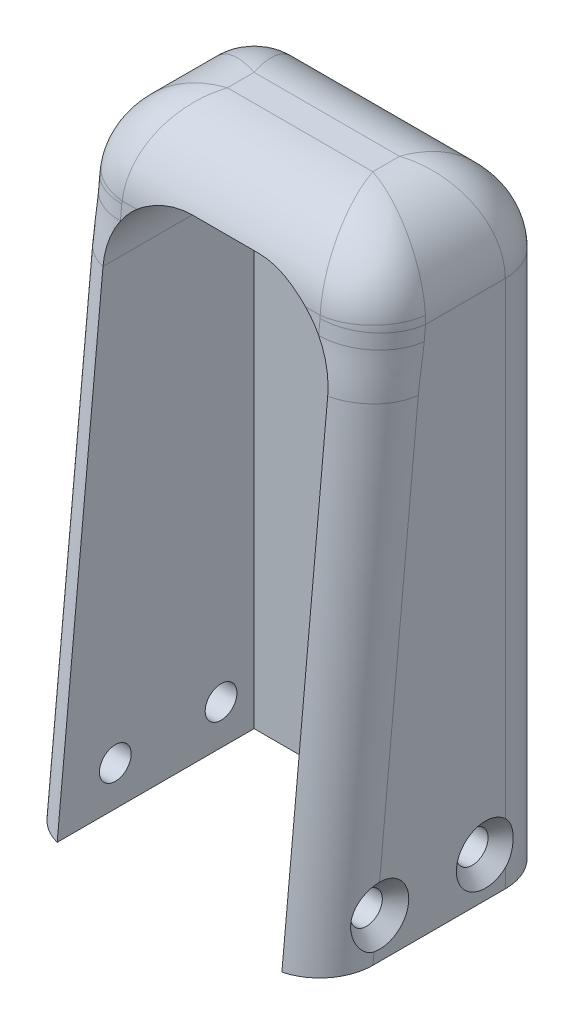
SolidWorks part; units mm, degrees
ref_plane "Plane1" through (0, 0, 0) normal (0, 0, 1) x (1, 0, 0)
ref_plane "Plane2" through (0, 0, 0) normal (0, 1, 0) x (1, 0, 0)
ref_plane "Plane3" through (0, 0, 0) normal (1, 0, 0) x (0, 0, -1)
sketch "Sketch1" plane through (0, 0, 0) normal (0, 0, 1) x (1, 0, 0)
  line L0 (-11.5, 0) -> (11.5, 0)
  line L1 (-11.5, 0) -> (-11.5, 40)
  line L2 (5.5, 46) -> (-5.5, 46)
  line L3 (11.5, 40) -> (11.5, 0)
  arc A0 (11.5, 40) -> (5.5, 46) centre (5.5, 40) ccw
  arc A1 (-11.5, 40) -> (-5.5, 46) centre (-5.5, 40) cw
  dimension "D1" = 6
  dimension "D4" = 6
  dimension "D2" = 46
  dimension "D3" = 23
extrude "Base-Extrude" add sketch "Sketch1" along normal blind 17.9
sketch "Sketch4" plane through (0, 0, 17.9) normal (0, 0, 1) x (1, 0, 0)
  line L0 (2.5, 42) -> (-2.5, 42)
  line L1 (8.5, 36) -> (8.5, 0)
  line L2 (-8.5, 0) -> (8.5, 0)
  line L3 (-8.5, 0) -> (-8.5, 36)
  arc A0 (-8.5, 36) -> (-2.5, 42) centre (-2.5, 36) cw
  arc A1 (8.5, 36) -> (2.5, 42) centre (2.5, 36) ccw
  dimension "D1" = 6
  dimension "D3" = 6
  dimension "D2" = 42
  dimension "D4" = 17
extrude "Hollow back" cut sketch "Sketch4" against normal offset from surface (14.9 mm away) 3
sketch "Sketch6" plane through (-11.5, 0, 0) normal (-1, 0, 0) x (0, 0, 1)
  line L0 (0, 0) -> (17.9, 0)
  line L1 (17.9, 0) -> (13.9931, 40.5751)
  line L3 (8.0207, 46) -> (6, 46)
  line L4 (0, 40) -> (0, 0)
  line L6 (17.9, 0) -> (17.9, 40) construction
  line L7 (17.9, 46) -> (0, 46) construction
  line L8 (0, 0) -> (0, 40) construction
  arc A0 (13.9931, 40.5751) -> (8.0207, 46) centre (8.0207, 40) ccw
  arc A1 (0, 40) -> (6, 46) centre (6, 40) cw
  dimension "D2" = 6
  dimension "D3" = 6
  dimension "D1" = 5.5
extrude "Side Profile cut" cut sketch "Sketch6" against normal through all flip side to cut
sketch "Sketch7" plane through (11.5, 0, 0) normal (1, 0, 0) x (0, 0, -1)
  line L0 (-17.9, 0) -> (0, 0) construction
  line L1 (0, 40) -> (0, 0) construction
  circle A0 centre (-5.5, 3) radius 1.1
  circle A1 centre (-13.5, 3) radius 1.1
  dimension "D1" = 2.2
  dimension "D2" = 3
  dimension "D3" = 5.5
  dimension "D4" = 13.5
extrude "Thru holes" cut sketch "Sketch7" against normal through all
sketch "Sketch8" plane through (11.5, 0, 0) normal (1, 0, 0) x (0, 0, -1)
  circle A0 centre (-5.5, 3) radius 2.5
  circle A1 centre (-13.5, 3) radius 2.5
  dimension "D1" = 5
extrude "Screw C'Sinks" cut sketch "Sketch8" against normal blind 2 draft 45
mirror "Screw C'Sinks - Mirror1" about plane through (0, 0, 0) normal (1, 0, 0)
fillet "Edge Rounds" radius 4 12 edges at (10, 0, 17.9) (-10, 0, 17.9) (-9.7426, 44.2426, 1.7574) (9.5342, 44.4413, 12.0549) (-9.5342, 44.4413, 12.0549) (11.5, 20, 15.9742) (11.4931, 40.2879, 14.0207) (-11.4931, 40.2879, 14.0207) (9.7426, 44.2426, 1.7574) (-11.5, 20, 15.9742) (11.5, 20, 0) (-11.5, 20, 0)
hole_wizard "CSK for M2 Flat Head Machine Screw1" positions "3DSketch1" profile "Sketch9" countersink size "M2" standard "Ansi Metric"
sketch3d "3DSketch1"
  arc A0 (-11.5, 1.948, 13.8215) -> (-11.5, 4.094, 13.6149) centre (-11.5, 3, 13.5) ccw construction
  circle A1 centre (-11.5, 3, 5.5) radius 1.1 construction
  arc A2 (11.5, 1.948, 13.8215) -> (11.5, 4.094, 13.6149) centre (11.5, 3, 13.5) ccw construction
  circle A3 centre (11.5, 3, 5.5) radius 1.1 construction
  point P7 (-11.5, 3, 13.5)
  point P9 (-11.5, 3, 5.5)
  point P11 (11.5, 3, 5.5)
  point P13 (11.5, 3, 13.5)
  point P23 (-10.4, 3, 13.5)
  point P27 (-10.4, 3, 5.5)
  point P32 (12.6, 3, 13.5)
  point P36 (12.6, 3, 5.5)
sketch "Sketch9" plane through (-11.5, 3, 13.5) normal (0, 1, 0) x (0, 0, 1)
  line L0 (0, 0) -> (0, 23.0644)
  line L1 (0, 23.0644) -> (1.2, 23.0644)
  line L2 (1.2, 23.0644) -> (1.2, 1)
  line L3 (1.2, 1) -> (2.2, 0)
  line L5 (2.2, 0) -> (0, 0)
  line L6 (-1.2, 1) -> (-2.2, 0) construction
  line L11 (0, -6.35) -> (0, 107.95) construction
  dimension "Thru Hole Dia." = 2.4
  dimension "Thru Hole Depth" = 23.0644
  dimension "Near C'Sink Dia." = 4.4
  dimension "Near C'Sink Angle" = 90
